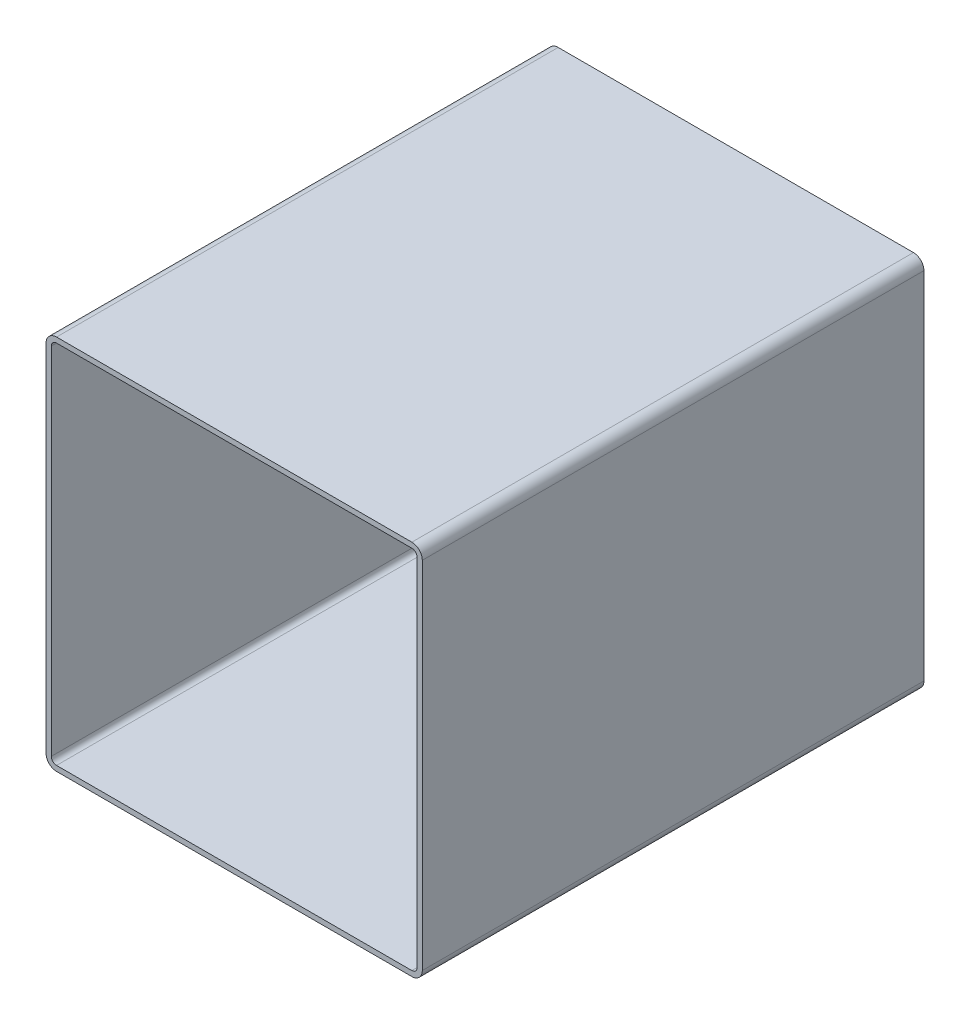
SolidWorks part; units mm, degrees
ref_plane "Front Plane" through (0, 0, 0) normal (0, 0, 1) x (1, 0, 0)
ref_plane "Top Plane" through (0, 0, 0) normal (0, 1, 0) x (1, 0, 0)
ref_plane "Right Plane" through (0, 0, 0) normal (1, 0, 0) x (0, 0, -1)
sketch "Sketch1" plane through (0, 0, 0) normal (0, 0, 1) x (1, 0, 0)
sketch_block_instance "HSS9x9x0.125-1"
sketch_block "HSS9x9x0.125"
extrude "Boss-Extrude1" add sketch "Sketch1" along normal blind 304.8
